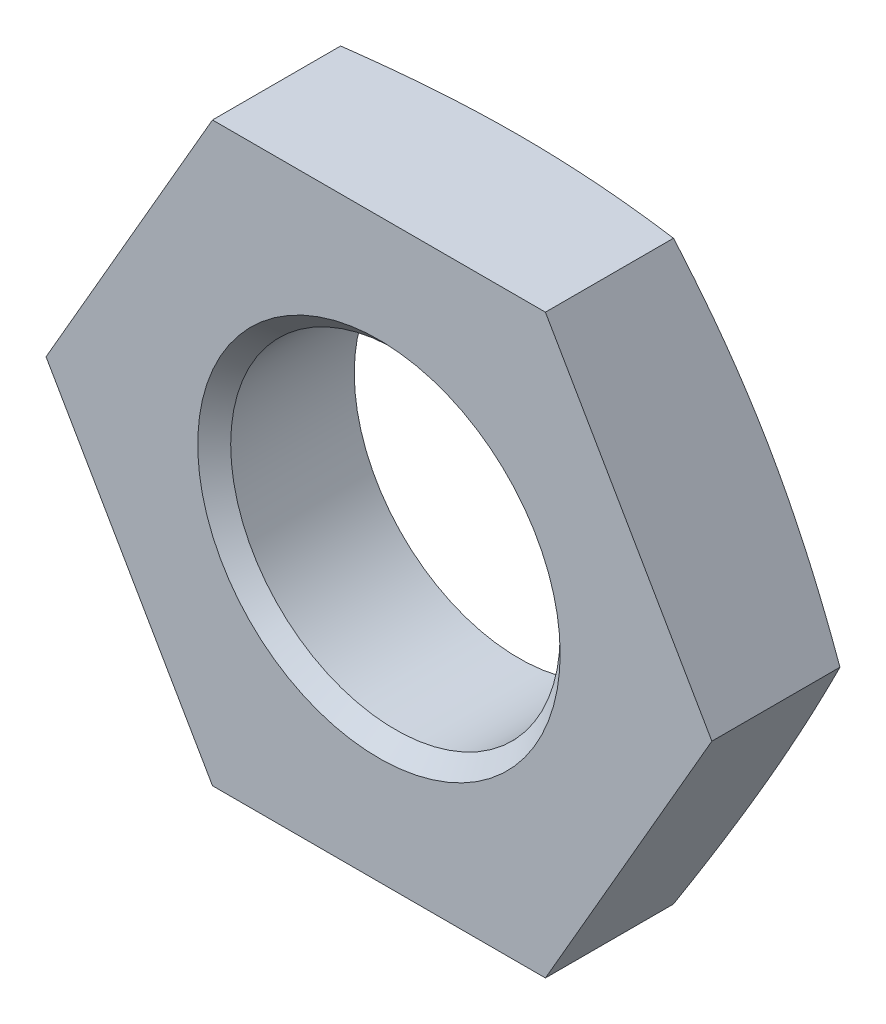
SolidWorks part; units mm, degrees
ref_plane "Front" through (0, 0, 0) normal (0, 0, 1) x (1, 0, 0)
ref_plane "Top" through (0, 0, 0) normal (0, 1, 0) x (1, 0, 0)
ref_plane "Right" through (0, 0, 0) normal (1, 0, 0) x (0, 0, -1)
sketch "Sketch1" plane through (0, 0, 0) normal (0, 0, 1) x (1, 0, 0)
  line L1 (2.0207, -3.5) -> (4.0415, 0)
  line L2 (4.0415, 0) -> (2.0207, 3.5)
  line L3 (2.0207, 3.5) -> (-2.0207, 3.5)
  line L4 (-2.0207, 3.5) -> (-4.0415, 0)
  line L5 (-4.0415, 0) -> (-2.0207, -3.5)
  line L6 (-2.0207, -3.5) -> (2.0207, -3.5)
  circle A0 centre (0, 0) radius 3.5 construction
  circle A1 centre (0, 0) radius 2
  dimension "D" = 4
  dimension "s" = 7
  dimension "e" = 8.0829
extrude "BaseNut" add sketch "Sketch1" against normal blind 1.7
sketch "Sketch2" plane through (0, 0, 0) normal (0, 1, 0) x (1, 0, 0)
  line L0 (-4.0415, 1.7) -> (-3.5, 1.7)
  line L2 (-3.5, 1.7) -> (-4.0415, 1.5549)
  line L3 (-4.0415, 1.5549) -> (-4.0415, 1.7)
  line L4 (0, 3.3759) -> (0, -9.8171) construction
  line L6 (-9.7712, 0.85) -> (9.8853, 0.85) construction
  dimension "dw" = 7
  dimension "D2" = 0.85
  dimension "Angle" = 15
revolve "Double-Chamfer" cut sketch "Sketch2" angle 360 about L4
chamfer "Chamfer1" distance 0.2 angle 45 1 edges at (2, 0, 0)
sketch "Sketch3" plane through (0, 0, 0) normal (0, 1, 0) x (1, 0, 0)
  line L0 (0, 2.7394) -> (0, -0.894) construction
  line L1 (1.75, 0.325) -> (2, 0.325)
  line L2 (2, 0.325) -> (2.2165, 0.2)
  line L3 (2.2165, 0.2) -> (2, 0.075)
  line L4 (2, 0.075) -> (1.75, 0.075)
  line L5 (1.75, 0.075) -> (1.75, 0.325)
  line L6 (2, 0.2) -> (-2, 0.2) construction
  dimension "D1" = 0.25
  dimension "D2" = 4
revolve "Cut-Revolve10" [suppressed] cut sketch "Sketch3" angle 360 about L0
pattern_linear "LPattern10" [suppressed] count 5 spacing 0.3 along (0, 0, 1)
equation "\"dw@Sketch2\" = \"s@Sketch1\""
equation "\"D2@Sketch2\" = \"m@BaseNut\" / 2"
equation "\"D1@Chamfer1\" = \"D@Sketch1\" / 20"
equation "\"D2@Sketch3\" = \"D@Sketch1\""
equation "\"D1@Sketch3\" = (  \"D2@ThreadCosmetic1\" - \"D@Sketch1\" )  / 2"
equation "\"D3@LPattern10\" = \"D1@Sketch3\" * 1.2"
equation "\"D1@LPattern10\" = (  \"m@BaseNut\"  - \"D1@Chamfer1\")  / \"D3@LPattern10\""
